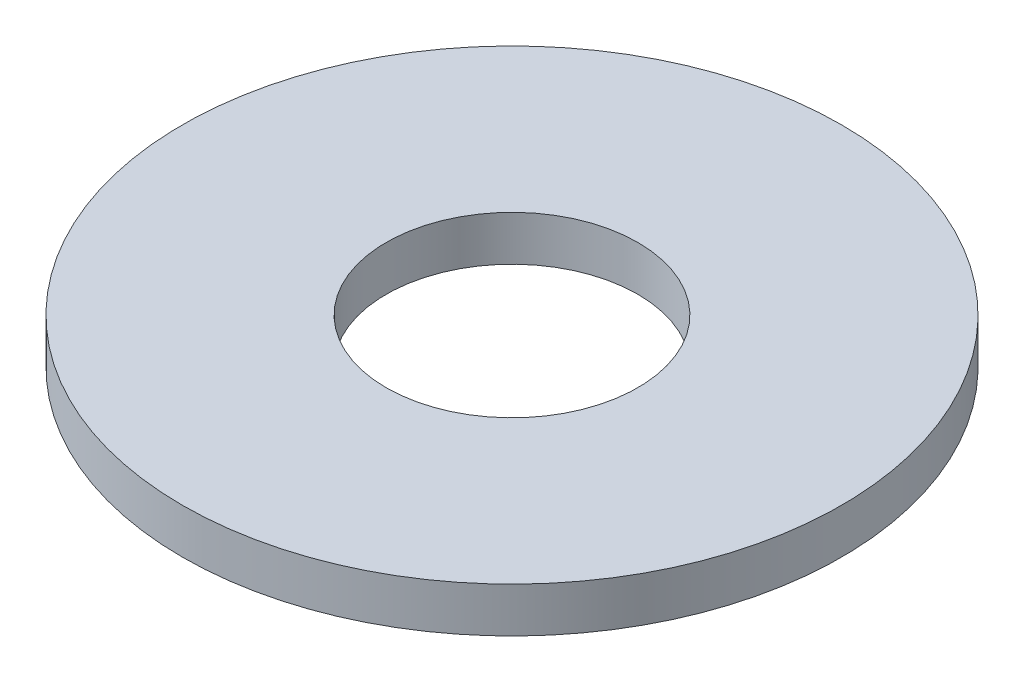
SolidWorks part; units mm, degrees
ref_plane "Face" through (0, 0, 0) normal (0, 0, 1) x (1, 0, 0)
ref_plane "Dessus" through (0, 0, 0) normal (0, 1, 0) x (1, 0, 0)
ref_plane "Droite" through (0, 0, 0) normal (1, 0, 0) x (0, 0, -1)
sketch "Esquisse1" plane through (0, 0, 0) normal (0, 1, 0) x (1, 0, 0)
  circle A0 centre (0, 0) radius 4.2
  circle A1 centre (0, 0) radius 11
  dimension "D1" = 8.4
  dimension "D2" = 22
extrude "Extrusion1" add sketch "Esquisse1" along normal blind 1.5
